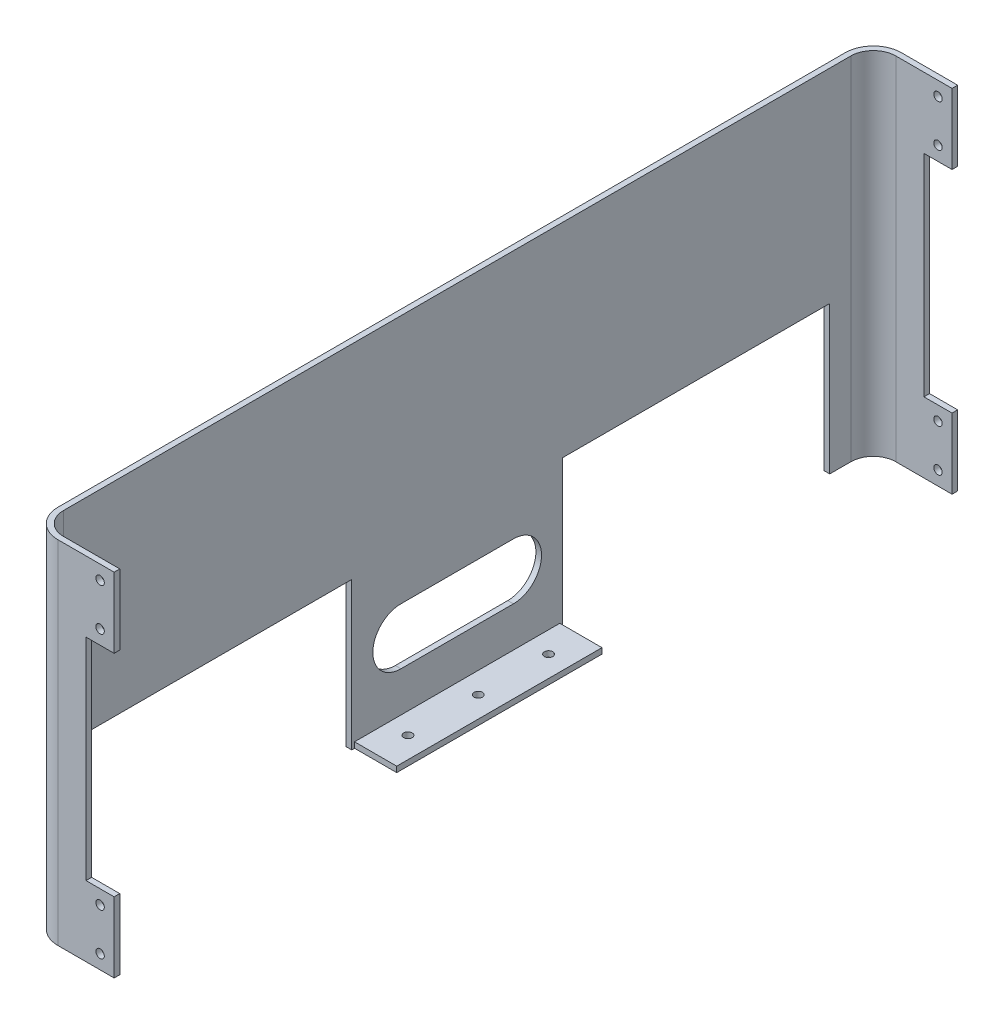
SolidWorks part; units mm, degrees
ref_plane "Plan de face" through (0, 0, 0) normal (0, 0, 1) x (1, 0, 0)
ref_plane "Plan de dessus" through (0, 0, 0) normal (0, 1, 0) x (1, 0, 0)
ref_plane "Plan de droite" through (0, 0, 0) normal (1, 0, 0) x (0, 0, -1)
sketch "Esquisse1" plane through (0, 0, 0) normal (0, 1, 0) x (1, 0, 0)
  line L0 (0, 0) -> (-40, 0)
  line L1 (-60, -20) -> (-60, -580)
  line L2 (-40, -600) -> (0, -600)
  line L3 (0, -4) -> (-40, -4)
  line L4 (-56, -20) -> (-56, -580)
  line L5 (-40, -596) -> (0, -596)
  line L6 (0, 0) -> (0, -4)
  line L7 (0, -600) -> (0, -596)
  arc A0 (-40, 0) -> (-60, -20) centre (-40, -20) ccw
  arc A1 (-60, -580) -> (-40, -600) centre (-40, -580) ccw
  arc A2 (-40, -4) -> (-56, -20) centre (-40, -20) ccw
  arc A3 (-56, -580) -> (-40, -596) centre (-40, -580) ccw
  dimension "D1" = 20
  dimension "D4" = 4
  dimension "D2" = 40
  dimension "D3" = 560
extrude "Boss.-Extru.1" add sketch "Esquisse1" along normal blind 250
sketch "Esquisse2" plane through (0, 0, 600) normal (0, 0, 1) x (1, 0, 0)
  line L0 (0, 250) -> (0, 0) construction
  line L1 (0, 200) -> (-20, 200)
  line L2 (0, 200) -> (0, 50)
  line L3 (0, 50) -> (-20, 50)
  line L4 (-20, 200) -> (-20, 50)
  line L5 (-40, 250) -> (-40, 0) construction
  line L8 (-40, 250) -> (0, 250) construction
  point P7 (0, 125)
  point P8 (0, 125)
  dimension "D1" = 20
  dimension "D2" = 50
extrude "Enlèv. mat.-Extru.1" cut sketch "Esquisse2" against normal up to surface (4 mm away)
sketch "Esquisse3" plane through (0, 0, 0) normal (0, 0, -1) x (-1, 0, 0)
  line L4 (20, 200) -> (0, 200)
  line L5 (20, 50) -> (20, 200)
  line L6 (0, 50) -> (20, 50)
  line L7 (0, 200) -> (0, 50)
  line L8 (20, 200) -> (0, 200)
  line L9 (20, 50) -> (20, 200)
  line L10 (0, 50) -> (20, 50)
  line L11 (0, 200) -> (0, 50)
  dimension "D1" = 0
extrude "Enlèv. mat.-Extru.2" cut sketch "Esquisse3" against normal up to surface (4 mm away)
sketch "Esquisse4" plane through (-60, 0, 0) normal (-1, 0, 0) x (0, 0, 1)
  line L0 (0, 175) -> (600, 175) construction
  line L3 (600, 250) -> (600, 0) construction
  line L4 (20, 250) -> (580, 250) construction
  text T0 "AMR-X  " font "Century Gothic" height 60
  dimension "D1" = 75
extrude "Enlèv. mat.-Extru.3" cut sketch "Esquisse4" against normal blind 1
sketch "Esquisse6" plane through (0, 0, 600) normal (0, 0, 1) x (1, 0, 0)
  line L0 (-20, 125) -> (-118.6602, 125) construction
  line L1 (-20, 200) -> (-20, 50) construction
  line L2 (-10, 240) -> (-10, 210) construction
  line L3 (0, 250) -> (0, 200) construction
  line L4 (0, 200) -> (-20, 200) construction
  line L5 (-10, 10) -> (-10, 40) construction
  circle A0 centre (-10, 240) radius 3
  circle A1 centre (-10, 210) radius 3
  circle A2 centre (-10, 40) radius 3
  circle A3 centre (-10, 10) radius 3
  point P10 (0, 225)
  point P11 (-10, 225)
  point P14 (-10, 200)
  dimension "D1" = 30
  dimension "D2" = 6
extrude "Enlèv. mat.-Extru.4" cut sketch "Esquisse6" against normal up to surface (4 mm away)
sketch "Esquisse7" plane through (0, 0, 0) normal (0, 0, -1) x (-1, 0, 0)
  circle A1 centre (10, 210) radius 3
  circle A2 centre (10, 210) radius 3
  circle A3 centre (10, 240) radius 3
  circle A4 centre (10, 240) radius 3
  circle A5 centre (10, 10) radius 3
  circle A6 centre (10, 10) radius 3
  circle A7 centre (10, 40) radius 3
  circle A8 centre (10, 40) radius 3
  dimension "D1" = 0
  dimension "D2" = 0
  dimension "D3" = 0
  dimension "D4" = 0
extrude "Enlèv. mat.-Extru.5" cut sketch "Esquisse7" against normal up to surface (4 mm away)
sketch "Esquisse8" plane through (-60, 0, 0) normal (-1, 0, 0) x (0, 0, 1)
  line L0 (0, 125) -> (600, 125) construction
  line L1 (0, 250) -> (0, 0) construction
  line L2 (600, 250) -> (600, 0) construction
  text T0 "  F" font "Century Gothic" height 45
extrude "Enlèv. mat.-Extru.6" cut sketch "Esquisse8" against normal blind 1
sketch "Esquisse9" plane through (-56, 0, 0) normal (1, 0, 0) x (0, 0, -1)
  line L1 (-375, 105) -> (-375, 0)
  line L2 (-375, 0) -> (-565, 0)
  line L4 (-565, 0) -> (-565, 105)
  line L8 (-565, 105) -> (-375, 105)
  line L9 (-580, 0) -> (-20, 0) construction
  line L10 (-600, 50) -> (-600, 0) construction
  line L11 (-300, 0) -> (-300, 250) construction
  line L12 (-580, 250) -> (-20, 250) construction
  line L13 (-35, 105) -> (-225, 105)
  line L14 (-35, 0) -> (-35, 105)
  line L15 (-225, 0) -> (-35, 0)
  line L16 (-225, 105) -> (-225, 0)
  dimension "D1" = 105
  dimension "D5" = 35
  dimension "D3" = 190
extrude "Enlèv. mat.-Extru.7" cut sketch "Esquisse9" against normal through all
sketch "Esquisse10" plane through (-56, 0, 0) normal (1, 0, 0) x (0, 0, -1)
  line L1 (-373, 0) -> (-227, 0)
  line L2 (-373, 0) -> (-373, 4)
  line L3 (-373, 4) -> (-227, 4)
  line L4 (-227, 0) -> (-227, 4)
  line L5 (-375, 0) -> (-225, 0) construction
  line L6 (-375, 0) -> (-375, 105) construction
  line L7 (-225, 105) -> (-225, 0) construction
  dimension "D1" = 4
  dimension "D2" = 2
  dimension "D3" = 2
extrude "Boss.-Extru.2" add sketch "Esquisse10" along normal blind 30
sketch "Esquisse11" plane through (0, 4, 0) normal (0, 1, 0) x (1, 0, 0)
  line L0 (-41, -227) -> (-41, -373) construction
  line L1 (-26, -227) -> (-56, -227) construction
  line L2 (-26, -373) -> (-56, -373) construction
  line L3 (-26, -227) -> (-26, -373) construction
  circle A0 centre (-41, -300) radius 3
  circle A1 centre (-41, -350) radius 3
  circle A2 centre (-41, -250) radius 3
  point P13 (-26, -300)
  dimension "D1" = 6
  dimension "D3" = 50
  dimension "D2" = 50
extrude "Enlèv. mat.-Extru.8" cut sketch "Esquisse11" against normal through all
sketch "Esquisse12" plane through (-60, 0, 0) normal (-1, 0, 0) x (0, 0, 1)
  line L0 (225, 52.5) -> (375, 52.5) construction
  line L1 (225, 105) -> (225, 0) construction
  line L2 (375, 0) -> (375, 105) construction
  line L3 (260, 52.5) -> (340, 52.5) construction
  line L4 (260, 72.5) -> (340, 72.5)
  line L5 (260, 32.5) -> (340, 32.5)
  arc A0 (260, 72.5) -> (260, 32.5) centre (260, 52.5) ccw
  arc A1 (340, 32.5) -> (340, 72.5) centre (340, 52.5) ccw
  point P8 (300, 52.5)
  point P13 (0, 0)
  dimension "D1" = 40
  dimension "D2" = 80
extrude "Enlèv. mat.-Extru.9" cut sketch "Esquisse12" against normal up to next
